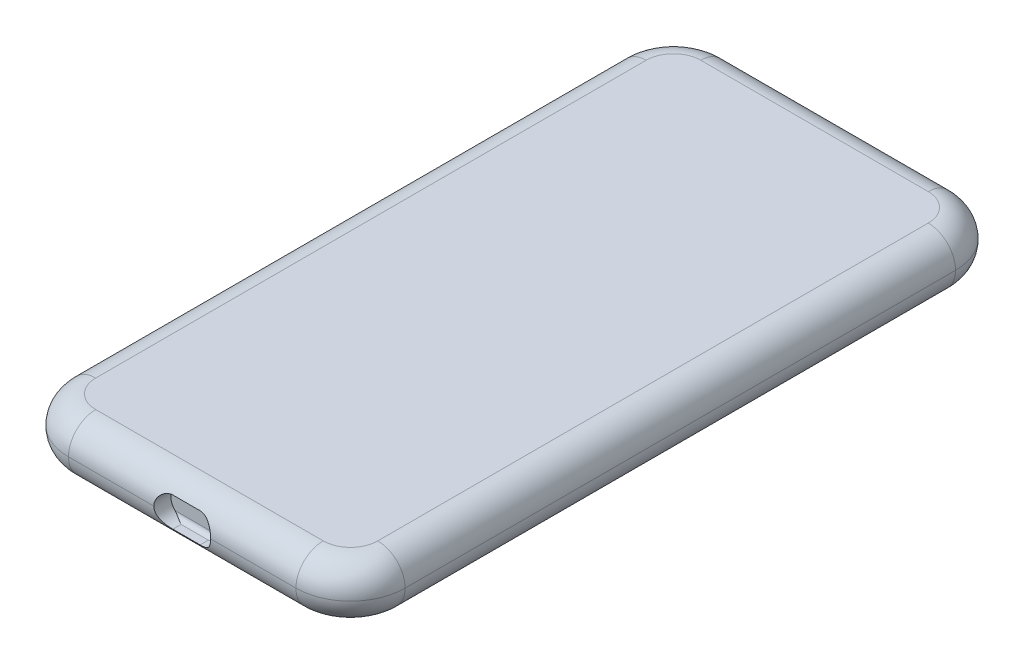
SolidWorks part; units mm, degrees
ref_plane "Front Plane" through (0, 0, 0) normal (0, 0, 1) x (1, 0, 0)
ref_plane "Top Plane" through (0, 0, 0) normal (0, 1, 0) x (1, 0, 0)
ref_plane "Right Plane" through (0, 0, 0) normal (1, 0, 0) x (0, 0, -1)
sketch "Sketch1" plane through (0, 0, 0) normal (0, 1, 0) x (1, 0, 0)
  line L1 (-37, 72.5) -> (37, 72.5)
  line L2 (-37, 72.5) -> (-37, -72.5)
  line L3 (-37, -72.5) -> (37, -72.5)
  line L4 (37, 72.5) -> (37, -72.5)
  line L5 (-37, 72.5) -> (37, -72.5) construction
  line L6 (-37, -72.5) -> (37, 72.5) construction
  point P0 (0, 0)
  dimension "D1" = 74
  dimension "D2" = 145
extrude "Boss-Extrude1" add sketch "Sketch1" along normal mid plane 12 contours L1 L4 L3 L2
fillet "Fillet1" radius 12 4 edges at (37, 0, 72.5) (-37, 0, 72.5) (37, 0, -72.5) (-37, 0, -72.5)
fillet "Fillet2" radius 6 16 edges at (33.4853, -6, -68.9853) (0, -6, -72.5) (-33.4853, -6, -68.9853) (-37, -6, 0) (-33.4853, -6, 68.9853) (0, -6, 72.5) (33.4853, -6, 68.9853) (37, -6, 0) (-33.4853, 6, 68.9853) (-37, 6, 0) (-33.4853, 6, -68.9853) (0, 6, -72.5) (33.4853, 6, -68.9853) (37, 6, 0) (33.4853, 6, 68.9853) (0, 6, 72.5)
ref_plane "Plane1" through (0, -5, 0) normal (0, 1, 0) x (1, 0, 0)
other "SurfaceCut1"
fillet "Fillet3" radius 2 8 edges at (31.5878, -5, -67.0878) (0, -5, -69.8166) (-31.5878, -5, -67.0878) (-34.3166, -5, 0) (-31.5878, -5, 67.0878) (0, -5, 69.8166) (31.5878, -5, 67.0878) (34.3166, -5, 0)
ref_plane "butt plane" through (0, 0, 72.5) normal (0, 0, 1) x (1, 0, 0)
sketch "Sketch2" plane through (0, 0, 72.5) normal (0, 0, 1) x (1, 0, 0)
  line L0 (-3, 0) -> (3, 0) construction
  line L1 (25, 0) -> (-25, 0) construction
  line L2 (-3, 3.25) -> (3, 3.25)
  line L3 (-3, -3.25) -> (3, -3.25)
  arc A0 (-3, 3.25) -> (-3, -3.25) centre (-3, 0) ccw
  arc A1 (3, -3.25) -> (3, 3.25) centre (3, 0) ccw
  point P5 (0, 0)
  dimension "D2" = 12.5
  dimension "D1" = 6.5
extrude "Cut-Extrude1" cut sketch "Sketch2" against normal blind 3.75
fillet "Fillet4" radius 1 2 edges at (0, 3.25, 68.75) (0, -3.25, 68.75)
ref_plane "port plane" through (0, 0, 0) normal (0, 1, 0) x (1, 0, 0)
